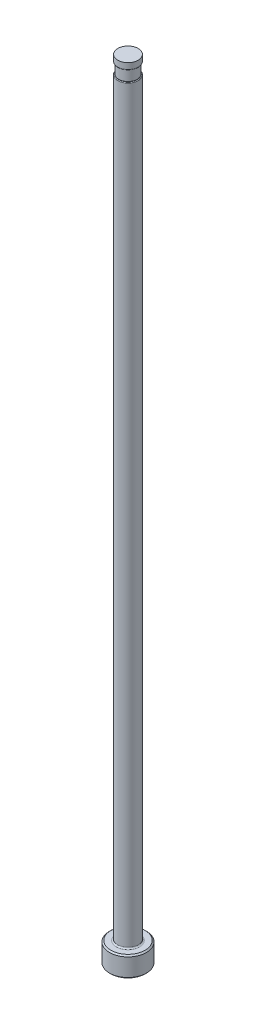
SolidWorks part; units mm, degrees
ref_plane "Front Plane" through (0, 0, 0) normal (0, 0, 1) x (1, 0, 0)
ref_plane "Top Plane" through (0, 0, 0) normal (0, 1, 0) x (1, 0, 0)
ref_plane "Right Plane" through (0, 0, 0) normal (1, 0, 0) x (0, 0, -1)
other "Configuration Table"
sketch "Sketch1" plane through (0, 0, 0) normal (0, 0, 1) x (1, 0, 0)
  line L0 (0, 259.9588) -> (0, -15.1925) construction
  line L1 (0, 0) -> (-3.5687, 0)
  line L2 (-3.5687, 0) -> (-3.5687, 3.9624)
  line L3 (-3.5687, 3.9624) -> (-1.9837, 3.9624)
  line L4 (-1.9837, 3.9624) -> (-1.9837, 152.4)
  line L5 (-1.9837, 152.4) -> (0, 152.4)
  line L6 (0, 152.4) -> (0, 0)
  dimension "L" = 152.4
  dimension "H" = 7.1374
  dimension "T" = 3.9624
  dimension "D" = 3.9675
revolve "Revolve1" add sketch "Sketch1" angle 360 about L0
chamfer "Chamfer1" distance 0.254 angle 45 2 edges at (0, 3.9624, 3.5687) (0, 0, 3.5687)
fillet "Fillet1" radius 0.254 1 edges at (0, 3.9624, 1.9837)
sketch "Sketch2" plane through (0, 0, 0) normal (0, 0, 1) x (1, 0, 0)
  line L0 (-1.9837, 152.4) -> (-1.9837, 4.2164) construction
  line L1 (-1.9837, 151.13) -> (-1.7805, 151.13)
  line L2 (-1.9837, 151.13) -> (-1.9837, 149.098)
  line L3 (-1.9837, 149.098) -> (-1.7805, 149.098)
  line L4 (-1.7805, 151.13) -> (-1.7805, 149.098)
  line L5 (1.9837, 152.4) -> (-1.9837, 152.4) construction
  line L6 (0, 153.4483) -> (0, 147.3282) construction
  dimension "D1" = 2.032
  dimension "N" = 1.27
  dimension "FD" = 0.2032
  dimension "D3" = 3.5611
revolve "Vent Relief" cut sketch "Sketch2" angle 360 about L6
sketch "Sketch3" plane through (0, 0, 0) normal (0, 0, 1) x (1, 0, 0)
  line L0 (-1.7805, 150.114) -> (-1.7805, 86.614)
  line L1 (-1.7805, 151.13) -> (-1.7805, 149.098) construction
  line L2 (-1.9837, 149.098) -> (-1.9837, 4.2164) construction
  line L3 (-1.9837, 85.4964) -> (-1.9837, 150.114)
  line L4 (-1.9837, 150.114) -> (-1.7805, 150.114)
  arc A0 (-1.7805, 86.614) -> (-1.9837, 85.4964) centre (-4.9555, 86.614) cw
  dimension "D1" = 3.175
  dimension "D2" = 63.5
extrude "D-Slot" cut sketch "Sketch3" against normal through all both and the other way through all
sketch "Sketch5" plane through (0, 0, 0) normal (0, 0, 1) x (1, 0, 0)
  line L0 (-1.9837, 151.13) -> (1.9837, 151.13) construction
  line L1 (-1.9837, 152.4) -> (-1.971, 152.4)
  line L2 (-1.9837, 152.4) -> (-1.9837, 151.13)
  line L3 (-1.9837, 151.13) -> (-1.971, 151.13)
  line L4 (-1.971, 152.4) -> (-1.971, 151.13)
  line L5 (0, 152.6877) -> (0, 150.5771) construction
  dimension "VP" = 0.0127
revolve "Vent Diameter" cut sketch "Sketch5" angle 360 about L5
fillet "Fillet2" radius 0.127 2 edges at (1.9837, 149.098, 0) (0, 151.13, 1.971)
sketch "Pocket Sketch" plane through (0, 0, 0) normal (0, 0, 1) x (1, 0, 0)
  line L0 (-3.9656, 0) -> (-3.9656, 3.9878)
  line L1 (-3.9656, 3.9878) -> (-2.9442, 3.9878)
  line L2 (-2.1822, 4.7498) -> (-2.1822, 22.225)
  line L3 (-2.1822, 22.225) -> (0, 22.225)
  line L4 (0, 22.225) -> (0, 0)
  line L5 (0, 0) -> (-3.9656, 0)
  line L6 (0, 12.6104) -> (0, -2.4989) construction
  line L7 (-3.5687, 3.7084) -> (-3.5687, 0.254) construction
  line L8 (3.3147, 3.9624) -> (-3.3147, 3.9624) construction
  line L9 (-1.9837, 85.4964) -> (-1.9837, 4.2164) construction
  line L10 (-2.9442, 3.9878) -> (-2.1822, 4.7498)
  point P3 (-2.1822, 3.9878)
  dimension "D1" = 7.9311
  dimension "D2" = 0.3969
  dimension "D3" = 0.0254
  dimension "D4" = 0.1984
  dimension "D5" = 4.3644
  dimension "D6" = 22.225
